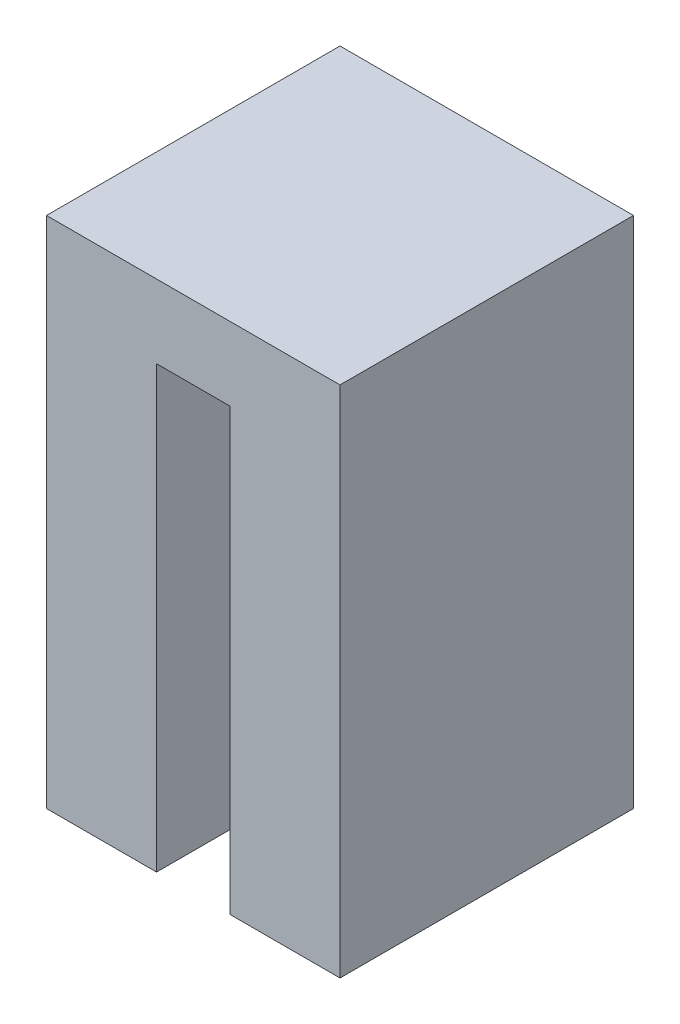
SolidWorks part; units mm, degrees
ref_plane "Plan de face" through (0, 0, 0) normal (0, 0, 1) x (1, 0, 0)
ref_plane "Plan de dessus" through (0, 0, 0) normal (0, 1, 0) x (1, 0, 0)
ref_plane "Plan de droite" through (0, 0, 0) normal (1, 0, 0) x (0, 0, -1)
sketch "Esquisse1" plane through (0, 0, 0) normal (0, 0, 1) x (1, 0, 0)
  line L0 (-25, -300) -> (-100, -300)
  line L1 (100, -300) -> (25, -300)
  line L2 (100, -300) -> (100, 50)
  line L3 (100, 50) -> (-100, 50)
  line L4 (-100, -300) -> (-100, 50)
  line L12 (-25, -300) -> (-25, 0)
  line L13 (-25, 0) -> (25, 0)
  line L14 (25, 0) -> (25, -300)
  dimension "D1" = 50
  dimension "D2" = 200
  dimension "D3" = 350
  dimension "D4" = 300
extrude "Boss.-Extru.1" add sketch "Esquisse1" against normal blind 200
